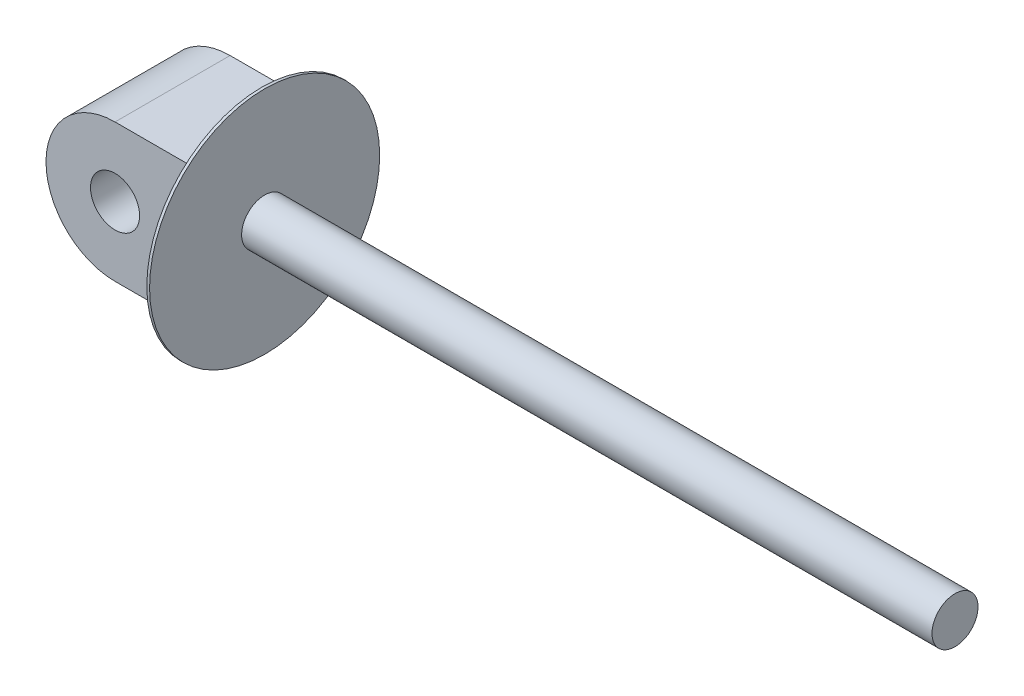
SolidWorks part; units mm, degrees
ref_plane "前视基准面" through (0, 0, 0) normal (0, 0, 1) x (1, 0, 0)
ref_plane "上视基准面" through (0, 0, 0) normal (0, 1, 0) x (1, 0, 0)
ref_plane "右视基准面" through (0, 0, 0) normal (1, 0, 0) x (0, 0, -1)
other "Configuration Table"
sketch "草图1" plane through (0, 0, 0) normal (0, 0, 1) x (1, 0, 0)
  line L0 (0, 4.5) -> (4, 4.5)
  line L1 (4, 4.5) -> (4, -4.5)
  line L2 (4, -4.5) -> (0, -4.5)
  circle A0 centre (0, 0) radius 1.6
  arc A1 (0, 4.5) -> (0, -4.5) centre (0, 0) ccw
  point P8 (0, 0)
  point P9 (0, 0)
  dimension "D1" = 3.2
  dimension "D2" = 4.5
  dimension "D3" = 4
extrude "凸台-拉伸1" add sketch "草图1" along normal mid plane 7.5
sketch "草图2" plane through (4, 0, 0) normal (1, 0, 0) x (0, 0, -1)
  circle A0 centre (0, 0) radius 7.5
  dimension "D1" = 15
extrude "凸台-拉伸2" add sketch "草图2" along normal blind 2
chamfer "倒角1" distance 5 angle 20 1 edges at (4, 7.5, 0)
sketch "草图3" plane through (6, 0, 0) normal (1, 0, 0) x (0, 0, -1)
  circle A0 centre (0, 0) radius 1.5
  dimension "D1" = 3
extrude "凸台-拉伸3" add sketch "草图3" along normal blind 45
